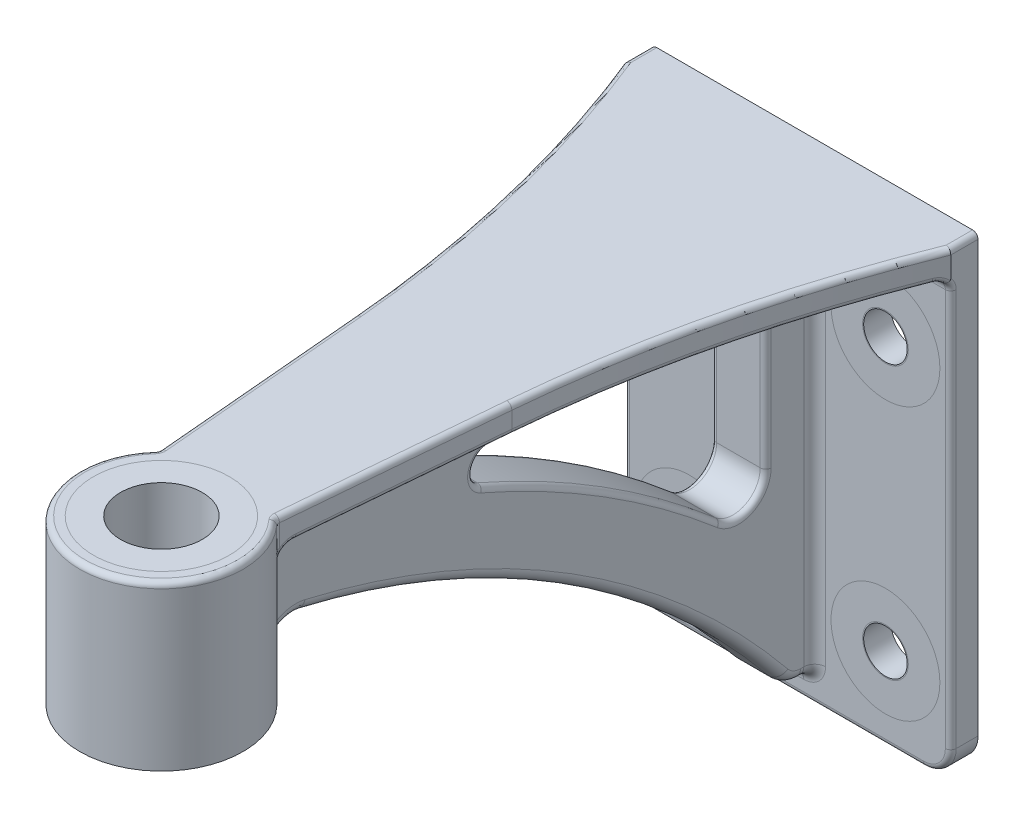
SolidWorks part; units mm, degrees
ref_plane "Front Plane" through (0, 0, 0) normal (0, 0, 1) x (1, 0, 0)
ref_plane "Top Plane" through (0, 0, 0) normal (0, 1, 0) x (1, 0, 0)
ref_plane "Right Plane" through (0, 0, 0) normal (1, 0, 0) x (0, 0, -1)
sketch "Sketch2" plane through (0, 0, 0) normal (0, 0, 1) x (1, 0, 0)
  line L1 (0, 0) -> (38.1, 0)
  line L2 (0, 0) -> (0, -107.95)
  line L3 (0, -107.95) -> (38.1, -107.95)
  line L4 (38.1, 0) -> (38.1, -107.95)
  dimension "D1" = 107.95
  dimension "D2" = 38.1
sketch "Sketch3" plane through (0, 0, 0) normal (1, 0, 0) x (0, 0, -1)
  line L0 (0, 0) -> (0, -101.6)
  line L1 (0, 0) -> (0, -107.95) construction
  line L2 (0, 0) -> (0, -107.95) construction
  line L3 (0, -101.6) -> (-12.7, -101.6)
  line L4 (0, 0) -> (-152.4, 0)
  line L5 (-152.4, 0) -> (-152.4, -25.4)
  arc A0 (-152.4, -25.4) -> (-12.7, -101.6) centre (-172.0833, -227.6444) cw
  dimension "D4" = 203.2
  dimension "D1" = 25.4
  dimension "D2" = 12.7
  dimension "D3" = 152.4
  dimension "D5" = 101.6
extrude "Boss-Extrude2" add sketch "Sketch3" along normal blind 6.35
extrude "Boss-Extrude3" add sketch "Sketch2" along normal blind 6.35
sketch "Sketch4" plane through (0, 0, 0) normal (0, 1, 0) x (1, 0, 0)
  line L0 (0, 0) -> (38.1, 0)
  line L1 (38.1, 0) -> (38.1, -6.35)
  line L2 (0, 0) -> (0, -152.4)
  line L3 (0, -152.4) -> (12.7, -152.4)
  line L4 (12.7, -152.4) -> (18.2555, -88.9)
  line L5 (18.2555, -88.9) -> (6.35, -88.9) construction
  line L6 (6.35, -6.35) -> (6.35, -152.4) construction
  arc A0 (18.2555, -88.9) -> (38.1, -6.35) centre (303.7945, -113.8814) cw
  dimension "D1" = 12.7
  dimension "D2" = 63.5
  dimension "D3" = 5
extrude "Boss-Extrude4" add sketch "Sketch4" against normal blind 6.35
sketch "Sketch5" plane through (0, 0, 6.35) normal (0, 0, 1) x (1, 0, 0)
  line L0 (22.86, -25.4) -> (22.86, -88.9) construction
  line L1 (0, -107.95) -> (38.1, -107.95) construction
  line L2 (6.35, -6.35) -> (38.1, -6.35) construction
  line L3 (38.1, -107.95) -> (38.1, -6.35) construction
  circle A0 centre (22.86, -25.4) radius 5.08
  circle A1 centre (22.86, -88.9) radius 5.08
  dimension "D4" = 10.16
  dimension "D1" = 19.05
  dimension "D2" = 19.05
  dimension "D3" = 15.24
extrude "Cut-Extrude1" cut sketch "Sketch5" against normal up to next
mirror "Mirror1" about plane through (0, -227.6444, 172.0833) normal (-1, 0, 0)
sketch "Sketch6" plane through (0, 0, 0) normal (0, 1, 0) x (1, 0, 0)
  line L0 (12.7, -152.4) -> (-12.7, -152.4) construction
  circle A0 centre (0, -152.4) radius 19.05
  dimension "D1" = 38.1
extrude "Boss-Extrude5" add sketch "Sketch6" against normal blind 38.1
sketch "Sketch7" plane through (0, 0, 0) normal (0, 1, 0) x (1, 0, 0)
  circle A0 centre (0, -152.4) radius 9.525
  dimension "D1" = 19.05
extrude "Cut-Extrude2" cut sketch "Sketch7" against normal up to next
fillet "Fillet1" radius 6.35 4 edges at (1.9825, -28.1501, 133.4534) (0, -101.6, 12.7) (38.1, -107.95, 3.175) (-38.1, -107.95, 3.175)
fillet "Fillet2" radius 2.54 19 edges at (6.35, -30.5702, 131.6146) (6.35, -101.6, 8.0026) (6.35, -100.9858, 12.3797) (22.225, -6.35, 6.35) (6.35, -6.35, 70.3947) (6.35, -21.0203, 134.4395) (6.35, -55.1477, 64.6817) (6.35, -53.975, 6.35) (-6.35, -53.975, 6.35) (-6.35, -101.6, 8.0026) (-6.35, -31.4852, 132.7233) (-6.35, -55.1477, 64.6817) (10.3875, -6.35, 136.4312) (-10.3875, -6.35, 136.4312) (-6.35, -21.0203, 134.4395) (-6.35, -6.35, 70.3947) (-22.225, -6.35, 6.35) (-6.35, -100.9858, 12.3797) (0, -101.6, 6.35)
fillet "Fillet3" radius 1.27 22 edges at (-25.1043, 0, 46.8862) (-16.0502, 0, 114.1074) (0, 0, 171.45) (16.0502, 0, 114.1074) (-38.1, 0, 3.175) (-13.8448, -4.445, 139.3148) (13.8448, -4.445, 139.3148) (38.1, 0, 3.175) (25.1043, 0, 46.8862) (13.8865, -7.5867, 138.8387) (16.1919, -6.35, 112.4873) (37.7541, -6.9862, 7.2086) (-13.9179, -7.2099, 138.479) (38.1, -55.245, 6.35) (36.2401, -106.0901, 6.35) (0, -107.95, 6.35) (-36.2401, -106.0901, 6.35) (-38.1, -55.245, 6.35) (-37.902, -7.3895, 6.8406) (-24.7879, -6.35, 48.2165) (24.7879, -6.35, 48.2165) (-16.1919, -6.35, 112.4873)
sketch "Sketch8" plane through (0, 0, 6.35) normal (0, 0, 1) x (1, 0, 0)
  circle A0 centre (22.86, -25.4) radius 12.7
  circle A1 centre (22.86, -25.4) radius 5.334
  circle A2 centre (22.86, -88.9) radius 12.7
  circle A3 centre (22.86, -88.9) radius 5.334
  circle A4 centre (-22.86, -88.9) radius 12.7
  circle A5 centre (-22.86, -88.9) radius 5.334
  circle A6 centre (-22.86, -25.4) radius 12.7
  circle A7 centre (-22.86, -25.4) radius 5.334
  dimension "D1" = 10.668
  dimension "D2" = 25.4
sketch "Sketch9" plane through (6.35, 0, 0) normal (1, 0, 0) x (0, 0, -1)
  line L8 (-17.78, -69.4589) -> (-17.78, -17.78)
  line L9 (-17.78, -17.78) -> (-102.8801, -17.78)
  line L10 (-17.78, -69.4589) -> (-17.78, -17.78)
  line L11 (-17.78, -17.78) -> (-102.8801, -17.78)
  arc A2 (-17.78, -69.4589) -> (-102.8801, -17.78) centre (-172.0833, -227.6444) ccw
  arc A3 (-17.78, -69.4589) -> (-102.8801, -17.78) centre (-172.0833, -227.6444) ccw
  dimension "D1" = 17.78
extrude "Cut-Extrude3" cut sketch "Sketch9" against normal through all
fillet "Fillet6" radius 6.35 1 edges at (0, -69.4589, 17.78)
fillet "Fillet4" radius 3.81 2 edges at (0, -17.78, 102.8801) (0, -17.78, 17.78)
fillet "Fillet5" radius 1.27 12 edges at (-6.35, -18.8959, 18.8959) (-6.35, -38.3201, 17.78) (-6.35, -40.4092, 54.7158) (-6.35, -20.8122, 85.9681) (6.35, -18.8959, 18.8959) (6.35, -38.3201, 17.78) (6.35, -40.4092, 54.7158) (6.35, -20.8122, 85.9681) (-6.35, -17.78, 51.9142) (6.35, -17.78, 51.9142) (-6.35, -60.8194, 21.4768) (6.35, -60.8194, 21.4768)
sketch "Sketch13" plane through (0, 0, 0) normal (0, 1, 0) x (1, 0, 0)
  circle A0 centre (0, -152.4) radius 15.875
  dimension "D1" = 31.75
